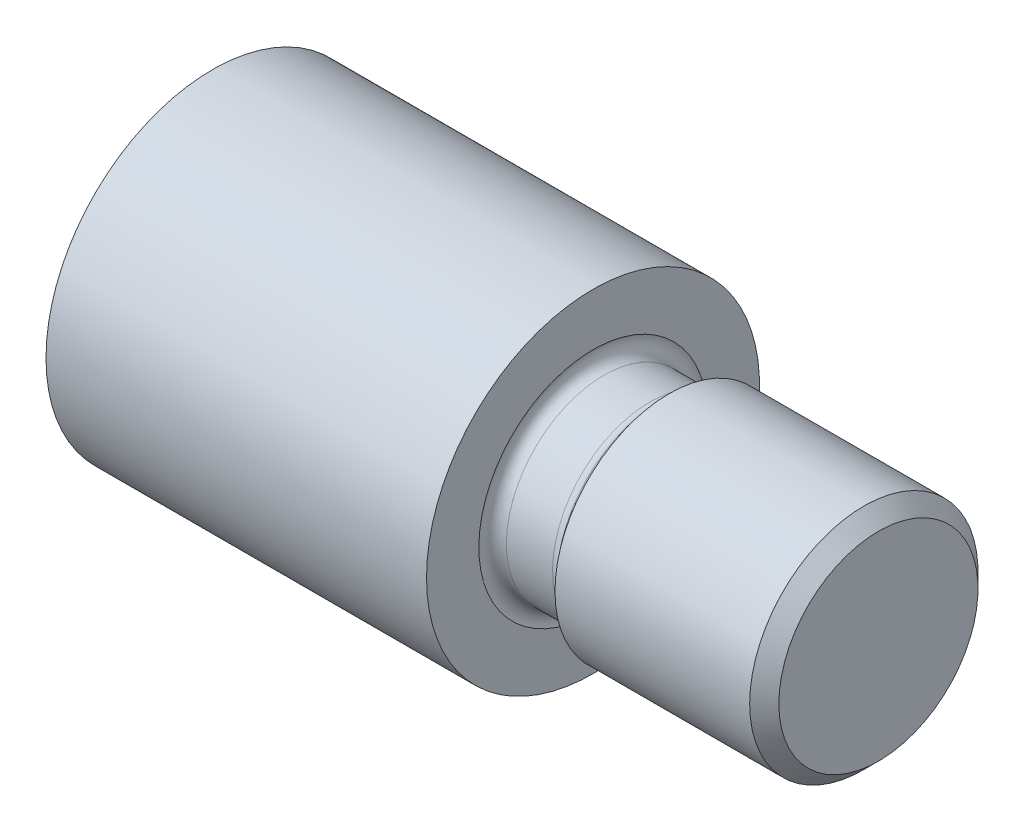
SolidWorks part; units mm, degrees
ref_plane "Vorne" through (0, 0, 0) normal (0, 0, 1) x (1, 0, 0)
ref_plane "Oben" through (0, 0, 0) normal (0, 1, 0) x (1, 0, 0)
ref_plane "Rechts" through (0, 0, 0) normal (1, 0, 0) x (0, 0, -1)
sketch "Skizze1" plane through (0, 0, 0) normal (0, 0, 1) x (1, 0, 0)
  line L0 (-69.3935, 0) -> (67.8717, 0) construction
  line L1 (70, 24) -> (10, 24)
  line L2 (-70, 0) -> (70, 0)
  line L3 (-70, 0) -> (-70, 35)
  line L4 (-70, 35) -> (10, 35)
  line L5 (70, 0) -> (70, 24)
  line L6 (10, 24) -> (10, 35)
  point P7 (0, 0)
  dimension "D1" = 70
  dimension "D2" = 140
  dimension "D3" = 48
  dimension "D4" = 60
revolve "Rotation1" add sketch "Skizze1" angle 360 about L0
sketch "Sketch2" plane through (70, 0, 0) normal (1, 0, 0) x (0, 0, -1)
  line L0 (0, 35) -> (0, -35) construction
  line L1 (-35, 0) -> (35, 0) construction
  circle A0 centre (0, 0) radius 35 construction
  circle A1 centre (0, 0) radius 35 construction
  point P4 (0, 35)
  point P5 (0, -35)
  point P8 (-35, 0)
  point P9 (35, 0)
  point P10 (0, 0)
ref_plane "Plane1" through (70, 0, 0) normal (0, 0, -1) x (-1, 0, 0)
sketch "Sketch3" plane through (70, 0, 0) normal (0, 0, -1) x (-1, 0, 0)
  line L0 (60, 24) -> (44, 24)
  line L1 (60, 24) -> (0, 24) construction
  line L2 (44, 24) -> (46.0472, 21.439)
  line L3 (48, 20.5) -> (57.7087, 20.5)
  line L4 (42.1548, 0) -> (-37.1209, 0) construction
  line L5 (60, 35) -> (60, -35) construction
  arc A0 (46.0472, 21.439) -> (48, 20.5) centre (48, 23) ccw
  arc A1 (57.7087, 20.5) -> (60, 24) centre (57.7087, 23) ccw
  dimension "D1" = 2.5
  dimension "D2" = 41
  dimension "D3" = 12
  dimension "D4" = 16
revolve "Cut-Revolve2" cut sketch "Sketch3" angle 360 about L4
chamfer "Chamfer1" distance 3.065 angle 45 1 edges at (70, 0, 24)
